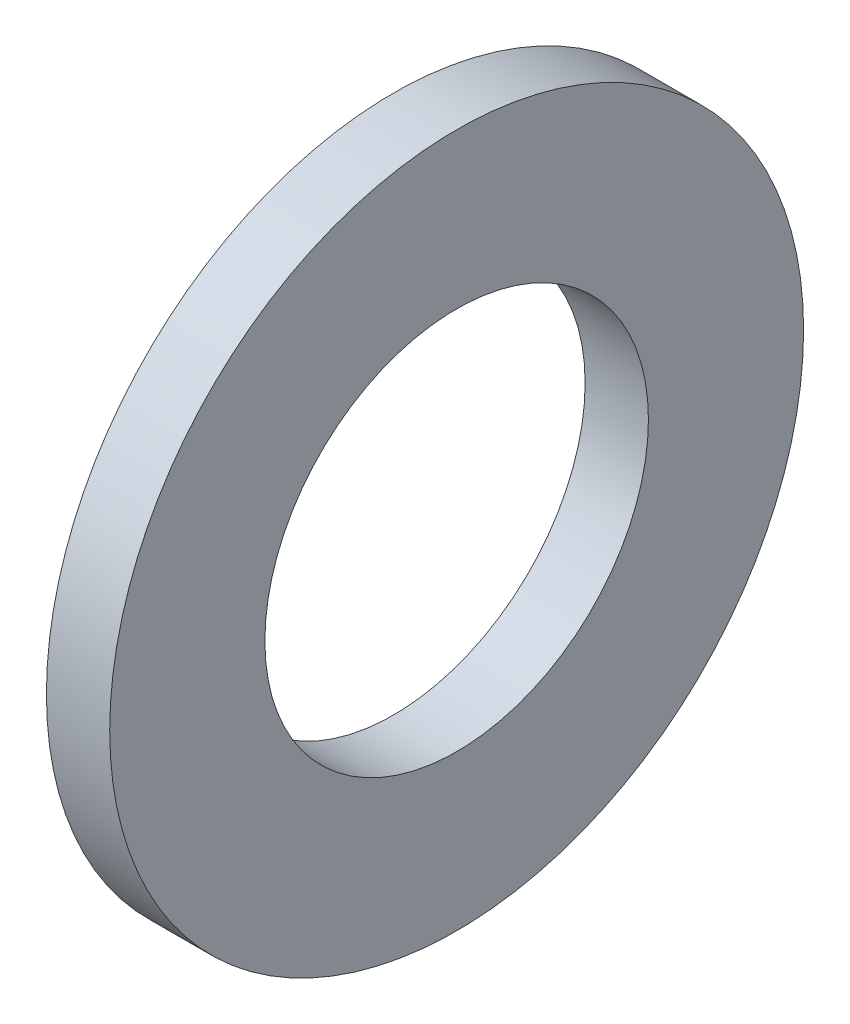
SolidWorks part; units mm, degrees
ref_plane "Plane1" through (0, 0, 0) normal (0, 0, 1) x (1, 0, 0)
ref_plane "Plane2" through (0, 0, 0) normal (0, 1, 0) x (1, 0, 0)
ref_plane "Plane3" through (0, 0, 0) normal (1, 0, 0) x (0, 0, -1)
sketch "Sketch1" plane through (0, 0, 0) normal (0, 0, 1) x (1, 0, 0)
  line L0 (-34.925, 0) -> (9.525, 0) construction
  line L1 (0, 10.3124) -> (0, 18.6563)
  line L2 (0, 18.6563) -> (-3.4036, 18.6563)
  line L3 (-3.4036, 18.6563) -> (-3.4036, 10.3124)
  line L4 (-3.4036, 10.3124) -> (0, 10.3124)
  dimension "Thickness" = 3.4036
  dimension "Inside_dia" = 20.6248
  dimension "Outside_dia" = 37.3126
revolve "Base-Revolve" add sketch "Sketch1" angle 360 about L0
